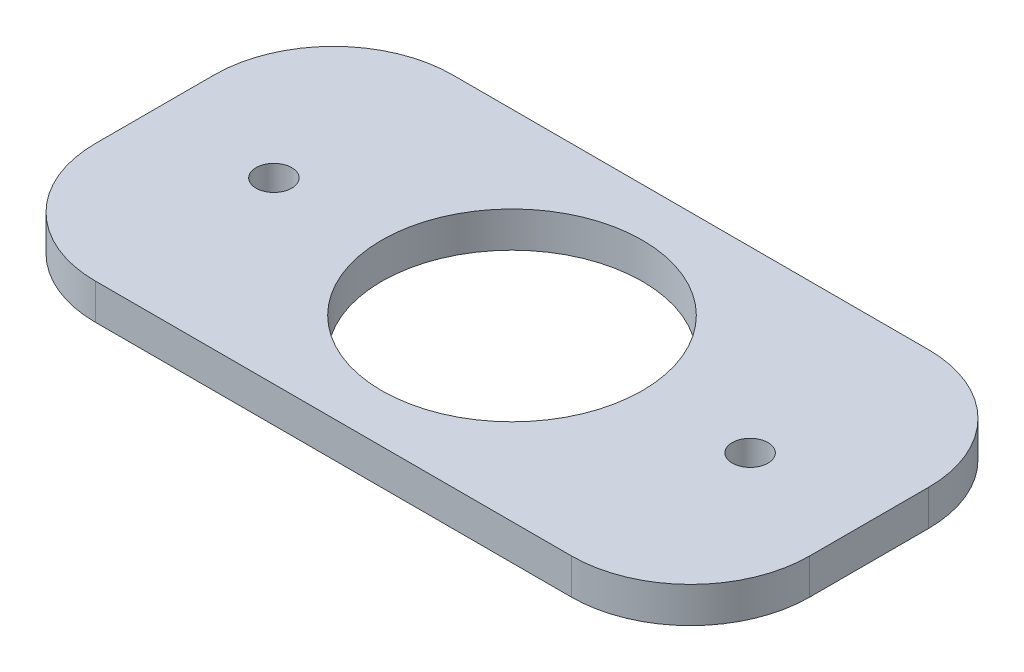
SolidWorks part; units mm, degrees
ref_plane "Alzado" through (0, 0, 0) normal (0, 0, 1) x (1, 0, 0)
ref_plane "Planta" through (0, 0, 0) normal (0, 1, 0) x (1, 0, 0)
ref_plane "Vista lateral" through (0, 0, 0) normal (1, 0, 0) x (0, 0, -1)
sketch "Croquis1" plane through (0, 0, 0) normal (0, 1, 0) x (1, 0, 0)
  line L1 (-30, -15) -> (30, -15)
  line L2 (-30, -15) -> (-30, 15)
  line L3 (-30, 15) -> (30, 15)
  line L4 (30, -15) -> (30, 15)
  line L5 (-30, -15) -> (30, 15) construction
  line L6 (-30, 15) -> (30, -15) construction
  point P0 (0, 0)
  dimension "D1" = 60
  dimension "D2" = 30
extrude "Saliente-Extruir2" add sketch "Croquis1" along normal blind 3
sketch "Croquis3" plane through (0, 3, 0) normal (0, 1, 0) x (1, 0, 0)
  circle A0 centre (0, 0) radius 10.95
  dimension "D1" = 21.9
extrude "Saliente-Extruir3" add sketch "Croquis3" along normal blind 1
sketch "Croquis4" plane through (0, 4, 0) normal (0, 1, 0) x (1, 0, 0)
  circle A0 centre (0, 0) radius 4
  dimension "D1" = 8
sketch "Croquis5" plane through (0, 3, 0) normal (0, 1, 0) x (1, 0, 0)
  point P6 (-8.3939, 8.4223)
sketch "Croquis6" plane through (0, 4, 0) normal (0, 1, 0) x (1, 0, 0)
  line L0 (-30, 0) -> (30, 0) construction
  circle A0 centre (-20, 0) radius 1.5
  circle A1 centre (20, 0) radius 1.5
  dimension "D1" = 3
  dimension "D2" = 3
  dimension "D3" = 20
  dimension "D4" = 20
extrude "Cortar-Extruir5" cut sketch "Croquis6" against normal blind 24
fillet "Redondeo1" radius 10 1 edges at (-30, 1.5, -15)
fillet "Redondeo2" radius 10 1 edges at (30, 1.5, -15)
fillet "Redondeo3" radius 10 1 edges at (-30, 1.5, 15)
fillet "Redondeo4" radius 10 1 edges at (30, 1.5, 15)
sketch "Croquis7" plane through (0, 4, 0) normal (0, 1, 0) x (1, 0, 0)
  circle A0 centre (0, 0) radius 10.95
extrude "Cortar-Extruir6" cut sketch "Croquis7" against normal blind 24
